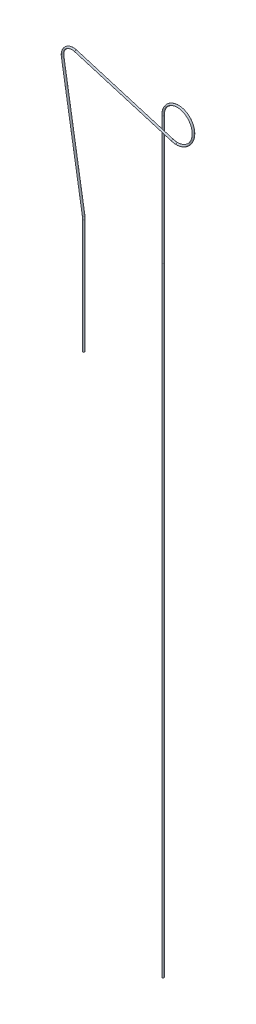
SolidWorks part; units mm, degrees
ref_plane "Спереди" through (0, 0, 0) normal (0, 0, 1) x (1, 0, 0)
ref_plane "Сверху" through (0, 0, 0) normal (0, 1, 0) x (1, 0, 0)
ref_plane "Справа" through (0, 0, 0) normal (1, 0, 0) x (0, 0, -1)
sketch "Эскиз1" plane through (0, 0, 0) normal (0, 0, 1) x (1, 0, 0)
  line L0 (0, 0) -> (0, -180) construction
  line L1 (0, 0) -> (-90, -155.8846) construction
  line L2 (0, 0) -> (90, -155.8846) construction
  line L3 (0, 0) -> (0, 205) construction
  line L4 (0, 0) -> (177.5352, 102.5) construction
  line L5 (62.6181, 50.8896) -> (62.5, -155.8689) construction
  line L6 (62.5, -155.8846) -> (62.5, -729.4854) construction
  line L7 (-75.8271, 73.3482) -> (80.8032, 26.4467)
  line L8 (88.1181, 50.875) -> (88.1181, 25.375) construction
  line L9 (-96.8409, 54.8601) -> (-62.8656, -151.4153)
  line L10 (-62.5, -155.8846) -> (-62.5, -340.8846)
  circle A0 centre (0, 0) radius 205 construction
  circle A1 centre (0, 0) radius 180 construction
  arc A2 (-62.5, -155.8846) -> (-62.8656, -151.4153) centre (-90, -155.8846) ccw
  circle A3 centre (90, -155.8846) radius 27.5 construction
  circle A4 centre (0, 0) radius 105 construction
  circle A5 centre (0, 0) radius 13.75 construction
  circle A6 centre (88.1181, 50.875) radius 88 construction
  arc A7 (80.8032, 26.4467) -> (88.1181, 25.375) centre (88.1181, 50.875) ccw
  circle A8 centre (0, 105) radius 11 construction
  circle A9 centre (0, 0) radius 88 construction
  circle A10 centre (-80.5603, 57.5417) radius 11 construction
  circle A11 centre (-80.5603, 57.5417) radius 82.5 construction
  arc A12 (-75.8271, 73.3482) -> (-96.8409, 54.8601) centre (-80.5603, 57.5417) ccw
  circle A13 centre (88.1181, 50.875) radius 25.5 construction
  dimension "D1" = 410
  dimension "D4" = 55
  dimension "D5" = 210
  dimension "D6" = 27.5
  dimension "D8" = 176
  dimension "D9" = 51
  dimension "D10" = 22
  dimension "D11" = 165
  dimension "D12" = 33
  dimension "D3" = 30
  dimension "D7" = 120
  dimension "D13" = 185
  dimension "D2" = 25
ref_plane "Плоскость1" through (0, -340.8846, 0) normal (0, 1, 0) x (-1, 0, 0)
sketch "Эскиз2" plane through (0, -340.8846, 0) normal (0, 1, 0) x (-1, 0, 0)
  circle A0 centre (62.5, 0) radius 1.495
  dimension "D1" = 2.99
sweep "По траектории1" add profiles "Эскиз2" path "Эскиз1"
sketch "Эскиз3" plane through (0, 0, 0) normal (0, 0, 1) x (1, 0, 0)
  circle A0 centre (88.1181, 50.875) radius 25.5 construction
  circle A1 centre (88.1181, 50.875) radius 25.5
curve "Спираль1"
sketch "Эскиз4" plane through (88.1181, 0, 0) normal (1, 0, 0) x (0, 0, -1)
  circle A1 centre (0, 25.375) radius 1.495
  circle A2 centre (0, 25.375) radius 1.495
  dimension "D1" = 0
sweep "По траектории2" add profiles "Эскиз4" path "Спираль1"
sketch "Эскиз5" plane through (0, 50.875, 0) normal (0, -1, 0) x (1, 0, 0)
  circle A1 centre (62.6181, -3) radius 1.495
  circle A2 centre (62.6181, -3) radius 1.495
  dimension "D1" = 0
ref_plane "Плоскость2" through (0, 0, -3) normal (0, 0, 1) x (1, 0, 0)
sketch "Эскиз6" plane through (0, 0, -3) normal (0, 0, 1) x (1, 0, 0)
  line L0 (62.6181, 50.8896) -> (62.5, -155.8689) construction
  line L1 (62.6181, 50.8896) -> (62.5, -155.8689)
  line L2 (62.5, -155.8689) -> (62.5, -1155.8689)
  line L3 (62.5, -155.8846) -> (62.5, -729.4854) construction
  dimension "D1" = 1000
sweep "По траектории4" add profiles "Эскиз5" path "Эскиз6"
